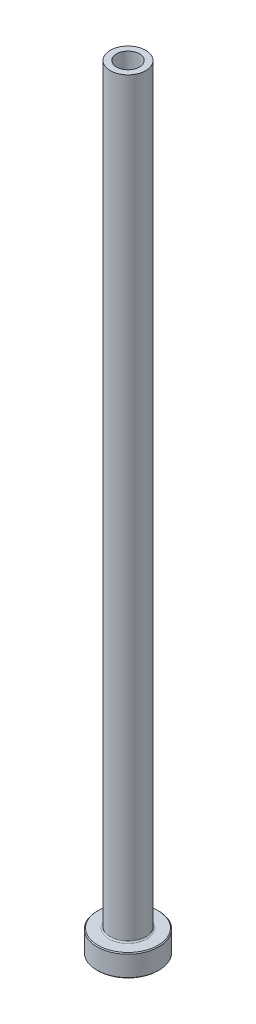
SolidWorks part; units mm, degrees
ref_plane "Front Plane" through (0, 0, 0) normal (0, 0, 1) x (1, 0, 0)
ref_plane "Top Plane" through (0, 0, 0) normal (0, 1, 0) x (1, 0, 0)
ref_plane "Right Plane" through (0, 0, 0) normal (1, 0, 0) x (0, 0, -1)
sketch "Sketch1" plane through (0, 0, 0) normal (0, 0, 1) x (1, 0, 0)
  line L0 (-2.6, 175) -> (-4, 175)
  line L1 (-4, 175) -> (-4, 5)
  line L2 (-4, 5) -> (-7, 5)
  line L3 (-7, 5) -> (-7, 0)
  line L4 (7.7, 0) -> (-7.7, 0) construction
  line L5 (-7, 0) -> (-2.85, 0)
  line L6 (-2.6, 130) -> (-2.6, 175)
  line L7 (0, 92.1877) -> (0, -15.5353) construction
  line L8 (0, -7.7) -> (0, 7.7) construction
  line L9 (-2.6, 130) -> (-2.85, 118)
  line L10 (-2.85, 118) -> (-2.85, 0)
  dimension "D1" = 0.25
  dimension "ID" = 5.2
  dimension "OD" = 8
  dimension "L" = 175
  dimension "H" = 14
  dimension "T" = 5
  dimension "N" = 45
  dimension "D2" = 12
revolve "Revolve1" add sketch "Sketch1" angle 360 about L7
fillet "Fillet1" radius 0.3 1 edges at (0, 5, 4)
chamfer "Chamfer1" distance 0.2 angle 45 2 edges at (0, 5, 7) (0, 0, 7)
chamfer "Chamfer3" distance 0.5 angle 45 1 edges at (0, 0, 2.85)
